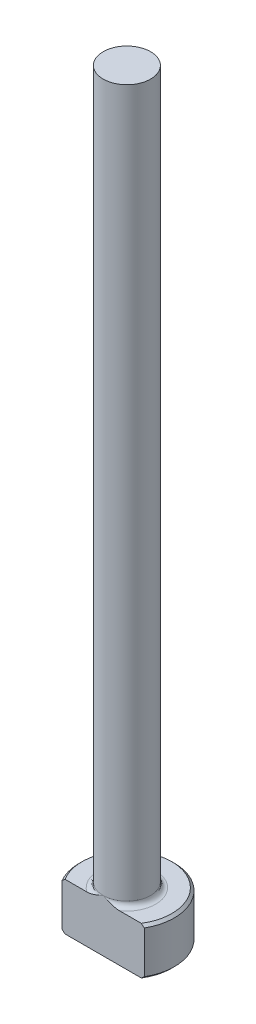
SolidWorks part; units mm, degrees
ref_plane "Front Plane" through (0, 0, 0) normal (0, 0, 1) x (1, 0, 0)
ref_plane "Top Plane" through (0, 0, 0) normal (0, 1, 0) x (1, 0, 0)
ref_plane "Right Plane" through (0, 0, 0) normal (1, 0, 0) x (0, 0, -1)
sketch "Sketch1" plane through (0, 0, 0) normal (0, 0, 1) x (1, 0, 0)
  line L0 (0, 259.9588) -> (0, -15.1925) construction
  line L1 (0, 0) -> (-4.7625, 0)
  line L2 (-4.7625, 0) -> (-4.7625, 4.7498)
  line L3 (-4.7625, 4.7498) -> (-2.3812, 4.7498)
  line L4 (-2.3812, 4.7498) -> (-2.3812, 76.2)
  line L5 (-2.3812, 76.2) -> (0, 76.2)
  line L6 (0, 76.2) -> (0, 0)
  dimension "L" = 76.2
  dimension "H" = 9.525
  dimension "T" = 4.7498
  dimension "D" = 4.7625
revolve "Revolve1" add sketch "Sketch1" angle 360 about L0
chamfer "Chamfer1" distance 0.254 angle 45 2 edges at (0, 4.7498, 4.7625) (0, 0, 4.7625)
fillet "Fillet1" radius 0.508 1 edges at (0, 4.7498, 2.3812)
sketch "Sketch2" plane through (0, 0, 0) normal (0, -1, 0) x (1, 0, 0)
  line L0 (-4.1244, 2.3812) -> (4.1244, 2.3812)
  arc A0 (4.1244, 2.3812) -> (-4.1244, 2.3812) centre (0, 0) ccw
  circle A1 centre (0, 0) radius 4.7625 construction
  circle A3 centre (0, 0) radius 2.3812 construction
extrude "KEY" cut sketch "Sketch2" against normal through all
sketch "Pocket Sketch" plane through (0, 0, 0) normal (0, 0, 1) x (1, 0, 0)
  line L0 (-5.1594, 0) -> (-5.1594, 4.7752)
  line L1 (-5.1594, 4.7752) -> (-3.3417, 4.7752)
  line L2 (-2.5797, 5.5372) -> (-2.5797, 22.225)
  line L3 (-2.5797, 22.225) -> (0, 22.225)
  line L4 (0, 22.225) -> (0, 0)
  line L5 (0, 0) -> (-5.1594, 0)
  line L6 (0, 12.6104) -> (0, -2.4989) construction
  line L7 (-4.7625, 4.4958) -> (-4.7625, 0.254) construction
  line L8 (4.5085, 4.7498) -> (-4.5085, 4.7498) construction
  line L9 (-2.3812, 76.2) -> (-2.3812, 5.2578) construction
  line L10 (-3.3417, 4.7752) -> (-2.5797, 5.5372)
  point P3 (-2.5797, 4.7752)
  dimension "D1" = 10.3187
  dimension "D2" = 0.3969
  dimension "D3" = 0.0254
  dimension "D4" = 0.1984
  dimension "D5" = 5.1594
  dimension "D6" = 22.225
